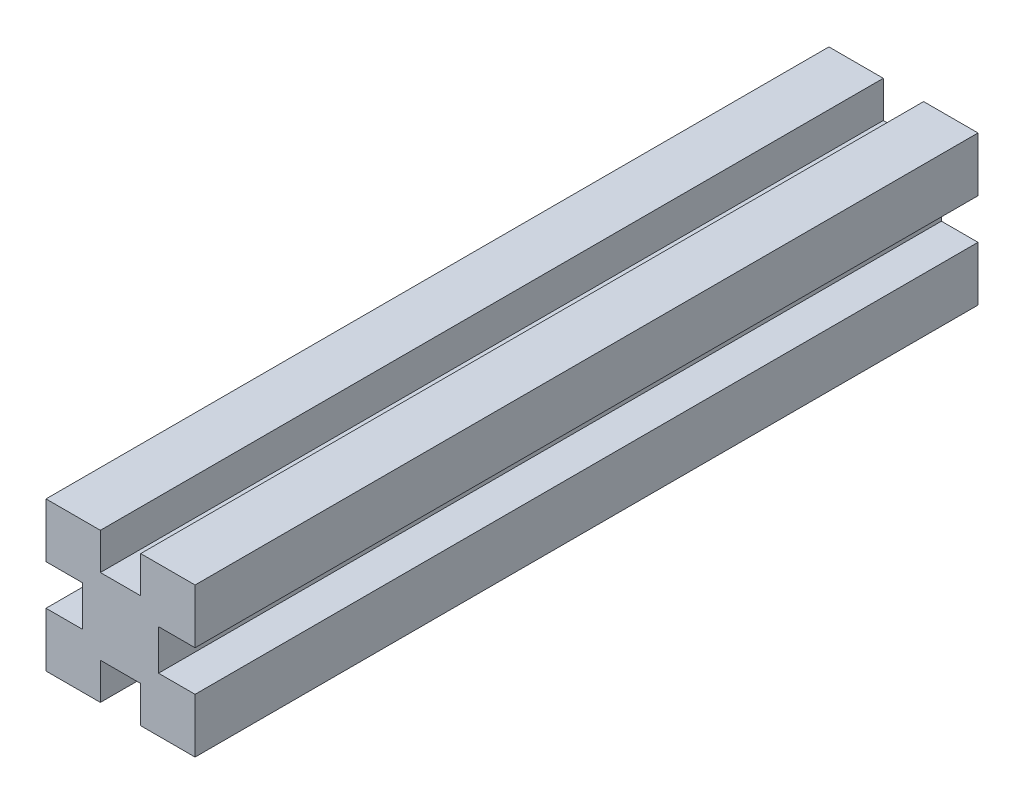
SolidWorks part; units mm, degrees
ref_plane "Ebene vorne" through (0, 0, 0) normal (0, 0, 1) x (1, 0, 0)
ref_plane "Ebene oben" through (0, 0, 0) normal (0, 1, 0) x (1, 0, 0)
ref_plane "Ebene rechts" through (0, 0, 0) normal (1, 0, 0) x (0, 0, -1)
sketch "Skizze1" plane through (0, 0, 0) normal (0, 0, 1) x (1, 0, 0)
  line L0 (0, 0) -> (0, 11.6)
  line L5 (0, 11.6) -> (7.8, 11.6)
  line L6 (11.6, 0) -> (11.6, 7.8)
  line L7 (11.6, 7.8) -> (20.2, 7.8)
  line L8 (20.2, 7.8) -> (20.2, 0)
  line L9 (0, 0) -> (11.6, 0)
  line L10 (20.2, 0) -> (31.8, 0)
  line L11 (7.8, 11.6) -> (7.8, 20.2)
  line L12 (7.8, 20.2) -> (0, 20.2)
  line L13 (0, 20.2) -> (0, 31.8)
  line L14 (0, 31.8) -> (11.6, 31.8)
  line L15 (11.6, 31.8) -> (11.6, 24)
  line L16 (11.6, 24) -> (20.2, 24)
  line L17 (20.2, 24) -> (20.2, 31.8)
  line L18 (20.2, 31.8) -> (31.8, 31.8)
  line L19 (31.8, 31.8) -> (31.8, 20.2)
  line L20 (31.8, 20.2) -> (24, 20.2)
  line L21 (24, 20.2) -> (24, 11.6)
  line L22 (24, 11.6) -> (31.8, 11.6)
  line L23 (31.8, 11.6) -> (31.8, 0)
  dimension "D1" = 7.8
  dimension "D2" = 31.8
  dimension "D3" = 8.6
extrude "Aufsatz-Linear austragen1" add sketch "Skizze1" along normal blind 167
